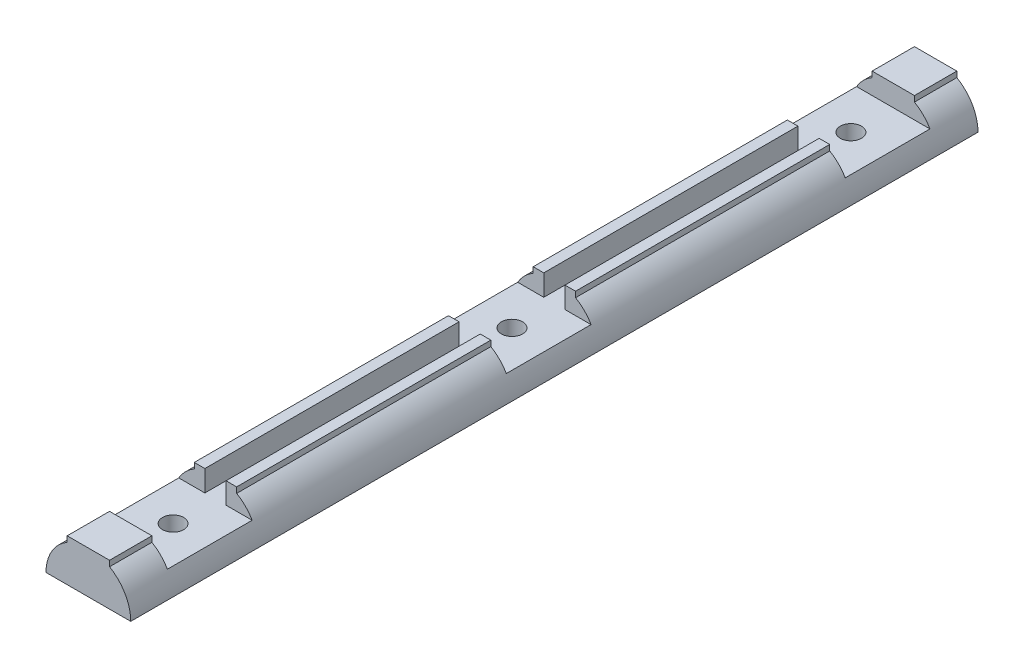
SolidWorks part; units mm, degrees
ref_plane "Front Plane" through (0, 0, 0) normal (0, 0, 1) x (1, 0, 0)
ref_plane "Top Plane" through (0, 0, 0) normal (0, 1, 0) x (1, 0, 0)
ref_plane "Right Plane" through (0, 0, 0) normal (1, 0, 0) x (0, 0, -1)
sketch "Sketch1" plane through (0, 0, 0) normal (0, 0, 1) x (1, 0, 0)
  circle A0 centre (0, 0) radius 10
  dimension "D1" = 20
extrude "Boss-Extrude1" add sketch "Sketch1" along normal mid plane 200
sketch "Sketch2" plane through (0, 0, 100) normal (0, 0, 1) x (1, 0, 0)
  line L1 (5, -10) -> (-5, -10)
  line L2 (5, -10) -> (5, 10)
  line L3 (5, 10) -> (-5, 10)
  line L4 (-5, -10) -> (-5, 10)
  line L5 (5, -10) -> (-5, 10) construction
  line L6 (5, 10) -> (-5, -10) construction
  circle A0 centre (0, 0) radius 10 construction
  point P0 (0, 0)
  dimension "D2" = 10
extrude "Boss-Extrude2" add sketch "Sketch2" against normal up to surface (200 mm away)
ref_plane "Plane1" through (0, 0, -80) normal (0, 0, -1) x (-1, 0, 0)
sketch "Sketch3" plane through (0, 0, -80) normal (0, 0, 1) x (1, 0, 0)
  line L1 (8.6603, 5) -> (-8.6603, 5)
  line L2 (8.6603, 5) -> (8.6603, 10)
  line L3 (8.6603, 10) -> (-8.6603, 10)
  line L4 (-8.6603, 5) -> (-8.6603, 10)
  line L5 (8.6603, 5) -> (-8.6603, 10) construction
  line L6 (8.6603, 10) -> (-8.6603, 5) construction
  circle A0 centre (0, 0) radius 10 construction
  point P0 (0, 7.5)
  dimension "D1" = 5
extrude "Cut-Extrude1" cut sketch "Sketch3" against normal mid plane 20
sketch "Sketch4" plane through (0, 5, 0) normal (0, 1, 0) x (1, 0, 0)
  line L0 (-8.6603, 90) -> (8.6603, 70) construction
  circle A0 centre (0, 80) radius 2.5
  dimension "D1" = 5
extrude "Cut-Extrude3" cut sketch "Sketch4" against normal through all
sketch "Sketch5" plane through (0, 10, 0) normal (0, 1, 0) x (1, 0, 0)
  line L0 (-8.6603, 70) -> (8.6603, 70) construction
  line L1 (2.5, -70) -> (-2.5, -70)
  line L2 (2.5, -70) -> (2.5, 70)
  line L3 (2.5, 70) -> (-2.5, 70)
  line L4 (-2.5, -70) -> (-2.5, 70)
  line L5 (2.5, -70) -> (-2.5, 70) construction
  line L6 (2.5, 70) -> (-2.5, -70) construction
  point P0 (0, 0)
  dimension "D1" = 5
extrude "Cut-Extrude2" cut sketch "Sketch5" against normal up to surface (5 mm away)
pattern_linear "LPattern1" count 3 spacing 80 along (0, 0, 1) of "Cut-Extrude1", "Cut-Extrude3"
sketch "Sketch6" plane through (0, 0, 100) normal (0, 0, 1) x (1, 0, 0)
  line L0 (-5, -10) -> (5, -10) construction
  line L1 (10, -10) -> (-10, -10)
  line L2 (10, -10) -> (10, 0)
  line L3 (10, 0) -> (-10, 0)
  line L4 (-10, -10) -> (-10, 0)
  line L5 (10, -10) -> (-10, 0) construction
  line L6 (10, 0) -> (-10, -10) construction
  arc A0 (-5, 8.6603) -> (-5, -8.6603) centre (0, 0) ccw construction
  point P0 (0, -5)
extrude "Cut-Extrude4" cut sketch "Sketch6" against normal through all
